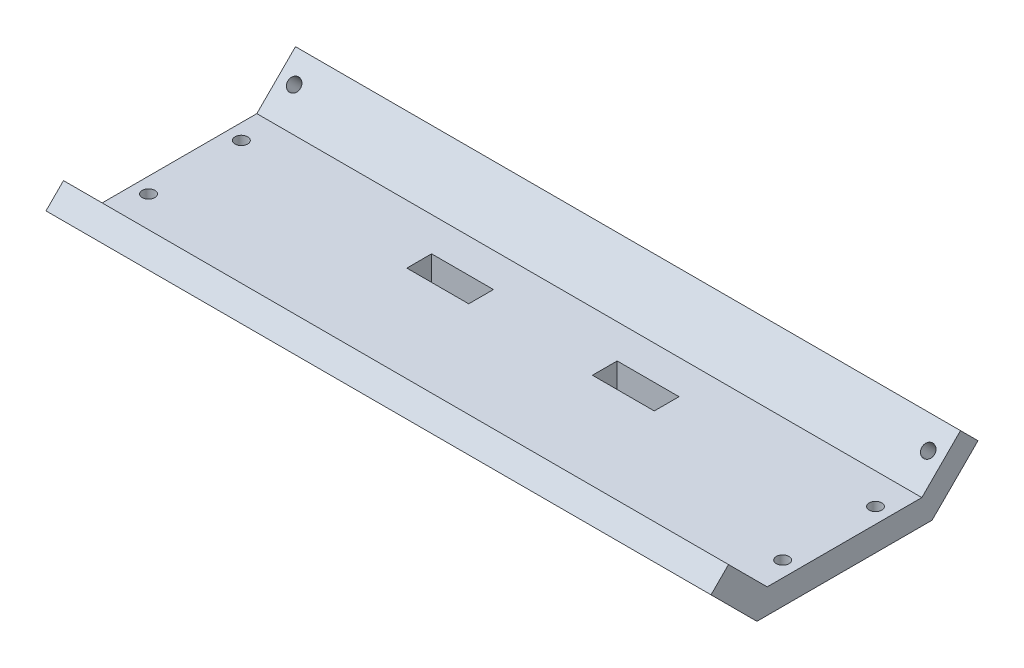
SolidWorks part; units mm, degrees
ref_plane "Front Plane" through (0, 0, 0) normal (0, 0, 1) x (1, 0, 0)
ref_plane "Top Plane" through (0, 0, 0) normal (0, 1, 0) x (1, 0, 0)
ref_plane "Right Plane" through (0, 0, 0) normal (1, 0, 0) x (0, 0, -1)
sketch "Sketch2" plane through (0, 0, 0) normal (1, 0, 0) x (0, 0, -1)
  line L0 (-25, 0) -> (25, 0)
  line L1 (25, 0) -> (37.5, 12.5)
  line L2 (-25, 0) -> (-37.5, 12.5)
  line L8 (28.3137, -8) -> (43.1569, 6.8431)
  line L9 (-28.3137, -8) -> (28.3137, -8)
  line L10 (-28.3137, -8) -> (-43.1569, 6.8431)
  line L11 (-37.5, 12.5) -> (-43.1569, 6.8431)
  line L12 (37.5, 12.5) -> (43.1569, 6.8431)
  line L13 (-37.5, 12.5) -> (-50, 25) construction
  line L14 (37.5, 12.5) -> (50, 25) construction
  point P4 (0, 0)
extrude "Main" add sketch "Sketch2" along normal mid plane 215
hole_wizard "Ø4.0mm Dowel Hole2" positions "3DSketch2" profile "Sketch4" hole size "Ø4.0" standard "ANSI Metric"
sketch3d "3DSketch2"
  line L2 (107.5, 0, -25) -> (-107.5, 0, -25) construction
  line L3 (-102.5, 0, -25) -> (-102.5, 0, -15) construction
  line L4 (-102.5, 0, -15) -> (-102.5, 0, 15) construction
  line L5 (-102.5, 0, 15) -> (-102.5, 0, 25) construction
  line L6 (107.5, 0, 25) -> (-107.5, 0, 25) construction
  line L11 (102.5, 0, -25) -> (102.5, 0, -15) construction
  line L12 (102.5, 0, -15) -> (102.5, 0, 15) construction
  line L13 (102.5, 0, 15) -> (102.5, 0, 25) construction
  line L27 (102.5, 0, -25) -> (102.5, 7.0711, -32.0711) construction
  line L29 (102.5, 0, 25) -> (102.5, 7.0711, 32.0711) construction
  line L31 (-102.5, 7.0711, 32.0711) -> (-102.5, 0, 25) construction
  line L35 (-102.5, 7.0711, -32.0711) -> (-107.5, 7.0711, -32.0711) construction
  line L36 (-107.5, 12.5, -37.5) -> (-107.5, 0, -25) construction
  line L38 (-102.5, 7.0711, 32.0711) -> (-107.5, 7.0711, 32.0711) construction
  line L39 (-107.5, 0, 25) -> (-107.5, 12.5, 37.5) construction
  line L41 (102.5, 7.0711, -32.0711) -> (107.5, 7.0711, -32.0711) construction
  line L42 (107.5, 12.5, -37.5) -> (107.5, 0, -25) construction
  line L44 (102.5, 7.0711, 32.0711) -> (107.5, 7.0711, 32.0711) construction
  line L45 (107.5, 0, 25) -> (107.5, 12.5, 37.5) construction
  line L47 (102.5, 0, 25) -> (107.5, 0, 25) construction
  line L49 (-102.5, 0, 25) -> (-107.5, 0, 25) construction
  line L51 (-102.5, 7.0711, -32.0711) -> (-102.5, 0, -25) construction
  point P0 (-102.5, 7.0711, -32.0711)
  point P2 (-102.5, 0, -15)
  point P4 (-102.5, 0, 15)
  point P6 (-102.5, 7.0711, 32.0711)
  point P8 (102.5, 7.0711, 32.0711)
  point P10 (102.5, 0, 15)
  point P12 (102.5, 0, -15)
  point P14 (102.5, 7.0711, -32.0711)
  dimension "D1" = 5
  dimension "D2" = 10
  dimension "D3" = 10
sketch "Sketch4" plane through (-102.5, 7.0711, -32.0711) normal (1, 0, 0) x (0, -0.7071, 0.7071)
  line L0 (0, 0) -> (0, 18.4957)
  line L1 (0, 18.4957) -> (2.05, 18.4957)
  line L2 (2.05, 18.4957) -> (2.05, 0)
  line L5 (2.05, 0) -> (0, 0)
  line L11 (0, -6.35) -> (0, 107.95) construction
  dimension "Thru Hole Dia." = 4.1
  dimension "Thru Hole Depth" = 18.4957
sketch "Sketch5" plane through (0, 0, 0) normal (0, 1, 0) x (1, 0, 0)
  line L0 (0, 0) -> (-50, 0) construction
  line L1 (-73.25, 11.775) -> (-26.75, 11.775) construction
  line L2 (-73.25, 11.775) -> (-73.25, -11.775) construction
  line L3 (-73.25, -11.775) -> (-26.75, -11.775) construction
  line L4 (-26.75, 11.775) -> (-26.75, -11.775) construction
  line L5 (-73.25, 11.775) -> (-26.75, -11.775) construction
  line L6 (-73.25, -11.775) -> (-26.75, 11.775) construction
  circle A0 centre (-73.25, 11.775) radius 4
  circle A1 centre (-26.75, 11.775) radius 4
  circle A2 centre (-26.75, -11.775) radius 4
  circle A3 centre (-73.25, -11.775) radius 4
  circle A4 centre (-73.25, 11.775) radius 2.05
  circle A5 centre (-26.75, 11.775) radius 2.05
  circle A6 centre (-26.75, -11.775) radius 2.05
  circle A7 centre (-73.25, -11.775) radius 2.05
  point P0 (-50, 0)
  dimension "D1" = 8
  dimension "D2" = 4.1
  dimension "D3" = 46.5
  dimension "D4" = 23.55
  dimension "D5" = 50
extrude "ESP32 pegs" [suppressed] add sketch "Sketch5" along normal blind 5.7
sketch "Sketch6" plane through (0, 0, 0) normal (0, 1, 0) x (1, 0, 0)
  line L0 (0, 0) -> (0, 10) construction
  line L1 (20, 14) -> (40, 14)
  line L2 (20, 14) -> (20, 6)
  line L3 (20, 6) -> (40, 6)
  line L4 (40, 14) -> (40, 6)
  line L5 (20, 14) -> (40, 6) construction
  line L6 (20, 6) -> (40, 14) construction
  line L7 (30, 10) -> (0, 10) construction
  line L8 (-40, 14) -> (-20, 14)
  line L9 (-40, 14) -> (-40, 6)
  line L10 (-40, 6) -> (-20, 6)
  line L11 (-20, 14) -> (-20, 6)
  line L12 (-40, 14) -> (-20, 6) construction
  line L13 (-40, 6) -> (-20, 14) construction
  line L14 (0, 10) -> (-30, 10) construction
  point P0 (30, 10)
  point P5 (-30, 10)
extrude "Shelf cut" cut sketch "Sketch6" against normal through all
equation "\"D1@Main\" = \"length\""
equation "\"D5@Sketch2\"=\"skin_th\""
equation "\"D1@Sketch2\"=\"height\""
equation "\"D2@Sketch6\"=\"skin_th\""
equation "\"length\" = 215mm"
equation "\"width\" = 220mm"
equation "\"height\" = 100mm"
equation "\"skin_th\" = 8mm"
equation "\"shelf_height\" = 10mm"
equation "\"D4@Sketch6\"=\"shelf_height\""
